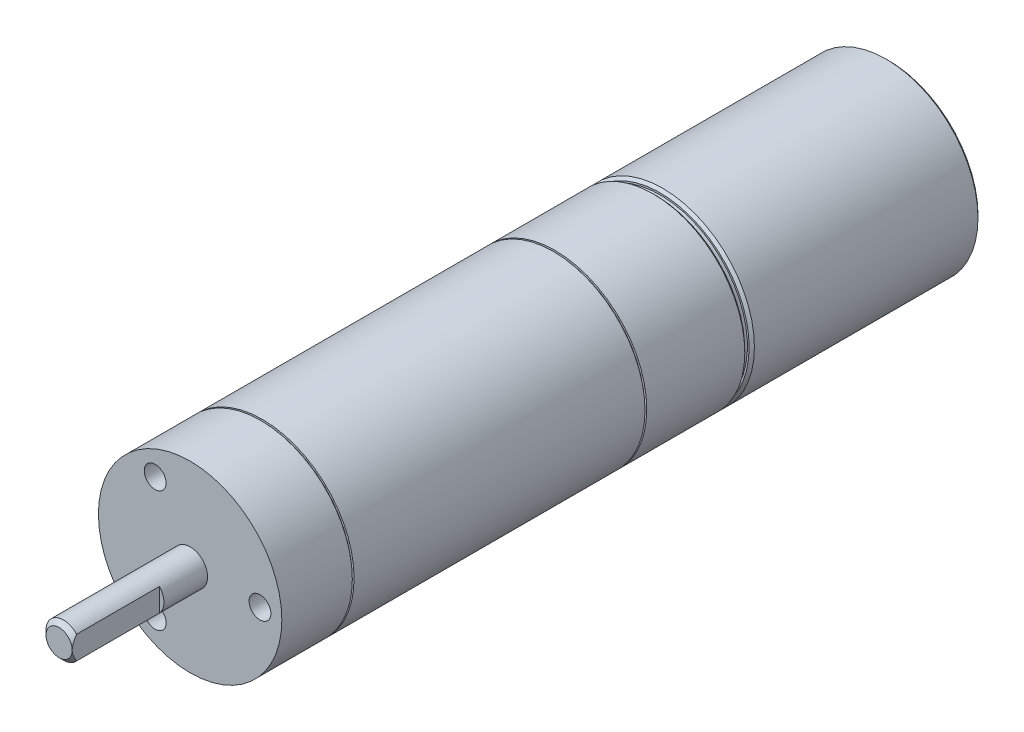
SolidWorks part; units mm, degrees
ref_plane "Plan de face" through (0, 0, 0) normal (0, 0, 1) x (1, 0, 0)
ref_plane "Plan de dessus" through (0, 0, 0) normal (0, 1, 0) x (1, 0, 0)
ref_plane "Plan de droite" through (0, 0, 0) normal (1, 0, 0) x (0, 0, -1)
sketch "Esquisse1" plane through (0, 0, 0) normal (0, 0, 1) x (1, 0, 0)
  circle A0 centre (0, 0) radius 10.5
  dimension "D1" = 21
extrude "Boss.-Extru.1" add sketch "Esquisse1" along normal blind 80
sketch "Esquisse2" plane through (0, 0, 80) normal (0, 0, 1) x (1, 0, 0)
  circle A0 centre (0, 0) radius 2
  dimension "D1" = 4
extrude "Boss.-Extru.2" add sketch "Esquisse2" along normal blind 15
chamfer "Chanfrein1" distance 0.5 angle 45 1 edges at (2, 0, 95)
sketch "Esquisse3" plane through (0, 0, 80) normal (0, 0, 1) x (1, 0, 0)
  line L0 (-13.9465, 0) -> (16.1451, 0) construction
  line L1 (-4, 6.9282) -> (0, 0) construction
  circle A0 centre (-4, 6.9282) radius 1.25
  circle A1 centre (8, 0) radius 1.25
  circle A2 centre (-4, -6.9282) radius 1.25
  dimension "D1" = 2.5
  dimension "D2" = 60
  dimension "D3" = 8
  dimension "D4" = 3
extrude "Enlèv. mat.-Extru.1" cut sketch "Esquisse3" against normal blind 5
sketch "Esquisse4" plane through (0, 0, 0) normal (0, 1, 0) x (1, 0, 0)
  line L0 (0, 6.6411) -> (0, -98.2739) construction
  line L1 (10.5, -80) -> (10.5, 0) construction
  line L2 (11.5069, -71.7284) -> (10.2762, -71.7284)
  line L3 (11.5069, -71.7284) -> (11.5069, -71.9284)
  line L4 (11.5069, -71.9284) -> (10.2762, -71.9284)
  line L5 (10.2762, -71.7284) -> (10.2762, -71.9284)
  line L6 (10.2762, -38.4215) -> (11.5069, -38.4215)
  line L7 (10.2762, -38.4215) -> (10.2762, -38.2215)
  line L8 (10.2762, -38.2215) -> (11.5069, -38.2215)
  line L9 (11.5069, -38.4215) -> (11.5069, -38.2215)
  line L10 (10, -26.1978) -> (10.6153, -26.1978)
  line L11 (10, -26.1978) -> (10, -26.6978)
  line L12 (10, -26.6978) -> (10.6153, -26.6978)
  line L13 (10.6153, -26.1978) -> (10.6153, -26.6978)
  dimension "D1" = 0.2
  dimension "D2" = 0.2
  dimension "D3" = 0.5
  dimension "D4" = 0.5
revolve "Enlèvement de matière-Révolution1" cut sketch "Esquisse4" angle 360 about L0
chamfer "Chanfrein2" distance 0.3 angle 45 3 edges at (10.5, 0, 26.1978) (10.5, 0, 0) (-10.5, 0, 26.6978)
sketch "Esquisse5" plane through (0, 0, 95) normal (0, 0, 1) x (1, 0, 0)
  line L1 (1.5, 2.8351) -> (4.1567, 2.8351)
  line L2 (1.5, 2.8351) -> (1.5, -2.3197)
  line L3 (1.5, -2.3197) -> (4.1567, -2.3197)
  line L4 (4.1567, 2.8351) -> (4.1567, -2.3197)
  dimension "D1" = 1.5
extrude "Enlèv. mat.-Extru.2" cut sketch "Esquisse5" against normal blind 10
